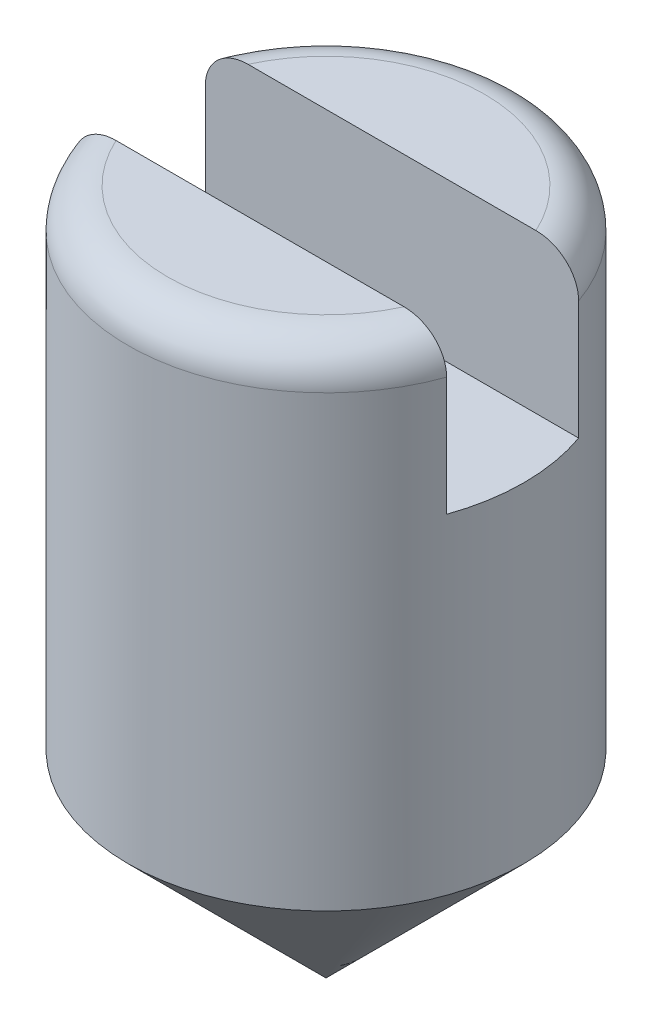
SolidWorks part; units mm, degrees
ref_plane "Plan de face" through (0, 0, 0) normal (0, 0, 1) x (1, 0, 0)
ref_plane "Plan de dessus" through (0, 0, 0) normal (0, 1, 0) x (1, 0, 0)
ref_plane "Plan de droite" through (0, 0, 0) normal (1, 0, 0) x (0, 0, -1)
sketch "Esquisse2" plane through (0, 0, 0) normal (0, 1, 0) x (1, 0, 0)
  circle A0 centre (0, 0) radius 1.5
extrude "Boss.-Extru.1" add sketch "Esquisse2" along normal blind 5.2
chamfer "Chanfrein1" distance 1.5 angle 45 1 edges at (0, 0, 1.5)
ref_plane "Plan1" through (0, 0, 0) normal (1, 0, 0) x (0, 0, -1)
sketch "Esquisse3" plane through (0, 0, 0) normal (1, 0, 0) x (0, 0, -1)
  line L0 (0, 5.6798) -> (0, 4.7609) construction
  line L1 (-2.1531, 5.2) -> (0.549, 5.2) construction
  line L2 (1.5, 5.2) -> (-1.5, 5.2) construction
  line L3 (-2.1531, 4) -> (0.549, 4) construction
  line L4 (-0.5, 6.2034) -> (-0.5, 3.7875) construction
  line L5 (0.5, 3.7875) -> (0.5, 6.2034) construction
  line L7 (-0.5, 4) -> (0.5, 4)
  line L8 (-0.5, 4) -> (-0.5, 5.2)
  line L9 (-0.5, 5.2) -> (0.5, 5.2)
  line L10 (0.5, 4) -> (0.5, 5.2)
  dimension "D1" = 1.2
  dimension "D2" = 0.5
  dimension "D3" = 1
extrude "Enlèv. mat.-Extru.1" cut sketch "Esquisse3" against normal mid plane 5.2
fillet "Congé1" radius 0.3 2 edges at (0, 5.2, -1.5) (0, 5.2, 1.5)
